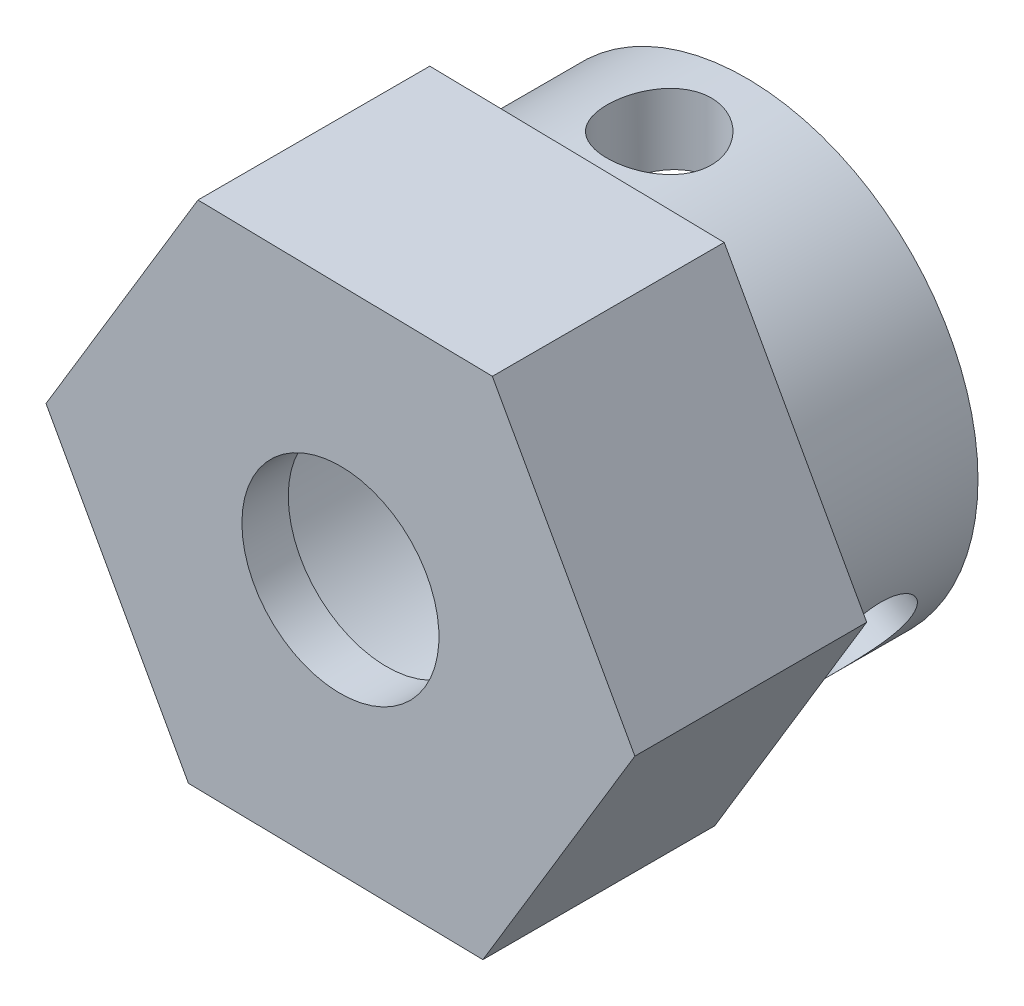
SolidWorks part; units mm, degrees
ref_plane "Front Plane" through (0, 0, 0) normal (0, 0, 1) x (1, 0, 0)
ref_plane "Top Plane" through (0, 0, 0) normal (0, 1, 0) x (1, 0, 0)
ref_plane "Right Plane" through (0, 0, 0) normal (1, 0, 0) x (0, 0, -1)
sketch "Sketch2" plane through (0, 0, 0) normal (0, 0, 1) x (1, 0, 0)
  circle A0 centre (0, 0) radius 5.08
  dimension "D1" = 10.16
extrude "Boss-Extrude2" add sketch "Sketch2" against normal blind 8.89
sketch "Sketch3" plane through (0, 0, -8.89) normal (0, 0, -1) x (-1, 0, 0)
  circle A0 centre (0, 0) radius 3.556
  dimension "D1" = 7.112
sketch "Sketch5" plane through (0, 0, 0) normal (0, 0, 1) x (1, 0, 0)
  line L1 (6.4514, -0.12) -> (3.3296, 5.527)
  line L2 (3.3296, 5.527) -> (-3.1218, 5.647)
  line L3 (-3.1218, 5.647) -> (-6.4514, 0.12)
  line L4 (-6.4514, 0.12) -> (-3.3296, -5.527)
  line L5 (-3.3296, -5.527) -> (3.1218, -5.647)
  line L6 (3.1218, -5.647) -> (6.4514, -0.12)
  circle A0 centre (0, 0) radius 5.588 construction
  dimension "D1" = 11.176
extrude "Boss-Extrude3" add sketch "Sketch5" against normal blind 5.08
extrude "Cut-Extrude3" cut sketch "Sketch3" against normal blind 7.874
sketch "Sketch6" plane through (0, 0, -5.08) normal (0, 0, -1) x (-1, 0, 0)
  circle A0 centre (0, 0) radius 2.159
  dimension "D1" = 4.318
extrude "Cut-Extrude4" cut sketch "Sketch6" against normal through all
sketch "Sketch7" plane through (0, 0, 0) normal (0, 1, 0) x (1, 0, 0)
  line L0 (5.08, 8.89) -> (-5.08, 8.89) construction
  circle A0 centre (0, 6.985) radius 1.143
  dimension "D1" = 2.286
  dimension "D2" = 1.905
extrude "Cut-Extrude5" cut sketch "Sketch7" along normal through all
pattern_circular "CirPattern1" count 3 every 120 about axis through (0, 0, 0) along (0, 0, -1) of "Cut-Extrude5"
